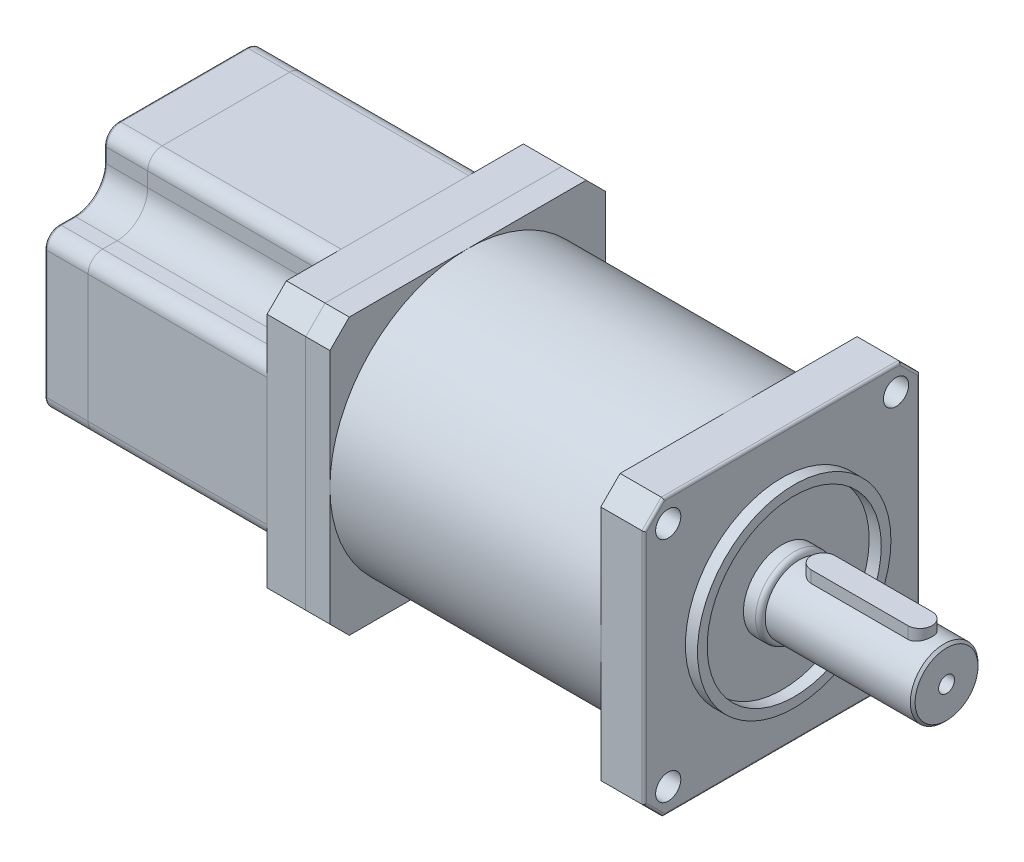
SolidWorks part; units mm, degrees
ref_plane "前视基准面" through (0, 0, 0) normal (0, 0, 1) x (1, 0, 0)
ref_plane "上视基准面" through (0, 0, 0) normal (0, 1, 0) x (1, 0, 0)
ref_plane "右视基准面" through (0, 0, 0) normal (1, 0, 0) x (0, 0, -1)
sketch "草图1" plane through (0, 0, 0) normal (1, 0, 0) x (0, 0, -1)
  line L0 (-28.5, 24.5) -> (-24.5, 28.5)
  line L1 (-24.5, -28.5) -> (24.5, -28.5)
  line L2 (-28.5, -24.5) -> (-28.5, 24.5)
  line L3 (-24.5, 28.5) -> (24.5, 28.5)
  line L4 (28.5, -24.5) -> (28.5, 24.5)
  line L5 (-28.5, -28.5) -> (28.5, 28.5) construction
  line L6 (-28.5, 28.5) -> (28.5, -28.5) construction
  line L7 (24.5, 28.5) -> (28.5, 24.5)
  line L8 (24.5, -28.5) -> (28.5, -24.5)
  line L9 (-28.5, -24.5) -> (-24.5, -28.5)
  point P0 (0, 0)
extrude "凸台-拉伸1" add sketch "草图1" against normal blind 9
sketch "草图2" plane through (-9, 0, 0) normal (-1, 0, 0) x (0, 0, 1)
  circle A0 centre (0, 0) radius 28.5
extrude "凸台-拉伸2" add sketch "草图2" along normal blind 56
sketch "草图3" plane through (-65, 0, 0) normal (-1, 0, 0) x (0, 0, 1)
  line L0 (0, 28.5) -> (24.5, 28.5) construction
  line L1 (-24.5, -28.5) -> (24.5, -28.5)
  line L2 (-28.5, -24.5) -> (-28.5, 24.5)
  line L3 (-24.5, 28.5) -> (24.5, 28.5)
  line L4 (28.5, -24.5) -> (28.5, 24.5)
  line L5 (-28.5, -28.5) -> (28.5, 28.5) construction
  line L6 (-28.5, 28.5) -> (28.5, -28.5) construction
  line L7 (-28.5, 24.5) -> (-24.5, 28.5)
  line L8 (24.5, 28.5) -> (28.5, 24.5)
  line L9 (24.5, -28.5) -> (28.5, -24.5)
  line L10 (-28.5, -24.5) -> (-24.5, -28.5)
  point P0 (0, 0)
extrude "凸台-拉伸3" add sketch "草图3" along normal blind 5
sketch "草图4" plane through (-70, 0, 0) normal (-1, 0, 0) x (0, 0, 1)
  line L0 (24.5, 28.5) -> (-24.5, 28.5) construction
  line L1 (-24.5, -28.5) -> (24.5, -28.5)
  line L2 (-28.5, -24.5) -> (-28.5, 24.5)
  line L3 (-24.5, 28.5) -> (24.5, 28.5)
  line L4 (28.5, -24.5) -> (28.5, 24.5)
  line L5 (-28.5, -28.5) -> (28.5, 28.5) construction
  line L6 (-28.5, 28.5) -> (28.5, -28.5) construction
  line L7 (-28.5, 24.5) -> (-24.5, 28.5)
  line L8 (24.5, 28.5) -> (28.5, 24.5)
  line L9 (24.5, -28.5) -> (28.5, -24.5)
  line L10 (-28.5, -24.5) -> (-24.5, -28.5)
  point P0 (0, 0)
extrude "凸台-拉伸4" add sketch "草图4" along normal blind 8 separate body
sketch "草图5" plane through (-78, 0, 0) normal (-1, 0, 0) x (0, 0, 1)
  line L0 (24.5, 28.5) -> (-24.5, 28.5) construction
  line L1 (-24.5, -28.5) -> (24.5, -28.5)
  line L2 (-28.5, -24.5) -> (-28.5, 24.5)
  line L3 (-24.5, 28.5) -> (24.5, 28.5)
  line L4 (28.5, -24.5) -> (28.5, 24.5)
  line L5 (-28.5, -28.5) -> (28.5, 28.5) construction
  line L6 (-28.5, 28.5) -> (28.5, -28.5) construction
  line L7 (-28.5, 24.5) -> (-24.5, 28.5)
  line L8 (-24.5, -28.5) -> (-28.5, -24.5)
  line L9 (24.5, -28.5) -> (28.5, -24.5)
  line L10 (28.5, 24.5) -> (24.5, 28.5)
  point P0 (0, 0)
extrude "凸台-拉伸5" add sketch "草图5" along normal blind 37 separate body
sketch "草图6" plane through (-115, 0, 0) normal (-1, 0, 0) x (0, 0, 1)
  line L0 (24.5, 28.5) -> (-24.5, 28.5) construction
  line L1 (-24.5, -28.5) -> (24.5, -28.5)
  line L2 (-28.5, -24.5) -> (-28.5, 24.5)
  line L3 (-24.5, 28.5) -> (24.5, 28.5)
  line L4 (28.5, -24.5) -> (28.5, 24.5)
  line L5 (-28.5, -28.5) -> (28.5, 28.5) construction
  line L6 (-28.5, 28.5) -> (28.5, -28.5) construction
  line L7 (-28.5, 24.5) -> (-24.5, 28.5)
  line L8 (-24.5, -28.5) -> (-28.5, -24.5)
  line L9 (24.5, -28.5) -> (28.5, -24.5)
  line L10 (28.5, 24.5) -> (24.5, 28.5)
  point P0 (0, 0)
extrude "凸台-拉伸6" add sketch "草图6" along normal blind 9 separate body
sketch "草图7" plane through (-124, 0, 0) normal (-1, 0, 0) x (0, 0, 1)
  line L0 (-22.5, 16.1754) -> (-25.5, 16.1754)
  line L1 (-28.5, 13.1754) -> (-28.5, 24.5)
  line L2 (-28.5, 24.5) -> (-24.5, 28.5)
  line L3 (-24.5, 28.5) -> (-13.1754, 28.5)
  line L4 (13.1754, 28.5) -> (24.5, 28.5)
  line L5 (24.5, 28.5) -> (28.5, 24.5)
  line L6 (28.5, 24.5) -> (28.5, 13.1754)
  line L7 (-28.5, 24.5) -> (-28.5, -24.5) construction
  line L9 (-25.5, -16.1754) -> (-22.5, -16.1754)
  line L10 (28.5, -13.1754) -> (28.5, -24.5)
  line L11 (-16.1754, -22.5) -> (-16.1754, -25.5)
  line L12 (-24.5, -28.5) -> (24.5, -28.5) construction
  line L14 (16.1754, -25.5) -> (16.1754, -22.5)
  line L15 (28.5, -24.5) -> (24.5, -28.5)
  line L16 (22.5, -16.1754) -> (25.5, -16.1754)
  line L17 (28.5, -24.5) -> (28.5, 24.5) construction
  line L19 (25.5, 16.1754) -> (22.5, 16.1754)
  line L20 (24.5, -28.5) -> (13.1754, -28.5)
  line L21 (16.1754, 22.5) -> (16.1754, 25.5)
  line L22 (24.5, 28.5) -> (-24.5, 28.5) construction
  line L24 (-16.1754, 25.5) -> (-16.1754, 22.5)
  line L25 (-13.1754, -28.5) -> (-24.5, -28.5)
  line L26 (-24.5, -28.5) -> (-28.5, -24.5)
  line L27 (-28.5, -24.5) -> (-28.5, -13.1754)
  arc A0 (-22.5, 16.1754) -> (-16.1754, 22.5) centre (-22.5, 22.5) ccw
  arc A1 (16.1754, 22.5) -> (22.5, 16.1754) centre (22.5, 22.5) ccw
  arc A2 (22.5, -16.1754) -> (16.1754, -22.5) centre (22.5, -22.5) ccw
  arc A3 (-16.1754, -22.5) -> (-22.5, -16.1754) centre (-22.5, -22.5) ccw
  arc A4 (-13.1754, 28.5) -> (-16.1754, 25.5) centre (-13.1754, 25.5) ccw
  arc A5 (16.1754, 25.5) -> (13.1754, 28.5) centre (13.1754, 25.5) ccw
  arc A6 (28.5, 13.1754) -> (25.5, 16.1754) centre (25.5, 13.1754) ccw
  arc A7 (25.5, -16.1754) -> (28.5, -13.1754) centre (25.5, -13.1754) ccw
  arc A8 (13.1754, -28.5) -> (16.1754, -25.5) centre (13.1754, -25.5) ccw
  arc A9 (-16.1754, -25.5) -> (-13.1754, -28.5) centre (-13.1754, -25.5) ccw
  arc A10 (-28.5, -13.1754) -> (-25.5, -16.1754) centre (-25.5, -13.1754) ccw
  arc A11 (-25.5, 16.1754) -> (-28.5, 13.1754) centre (-25.5, 13.1754) ccw
  point P0 (0, 0)
  point P10 (-16.1754, 28.5)
  point P39 (16.1754, 28.5)
  point P42 (28.5, 16.1754)
  point P45 (28.5, -16.1754)
  point P48 (16.1754, -28.5)
  point P51 (-16.1754, -28.5)
  point P54 (-28.5, -16.1754)
  point P57 (-28.5, 16.1754)
  dimension "D1" = 3
extrude "切除-拉伸1" cut sketch "草图7" against normal blind 46
fillet "圆角1" radius 0.5 24 edges at (-124, 28.5, 0) (-124, 27.6213, 15.2968) (-124, 24, 16.1754) (-124, 18.0279, 18.0279) (-124, 16.1754, 24) (-124, 15.2968, 27.6213) (-124, 0, 28.5) (-124, -15.2968, 27.6213) (-124, -16.1754, 24) (-124, -18.0279, 18.0279) (-124, -24, 16.1754) (-124, -27.6213, 15.2968) (-124, -28.5, 0) (-124, -27.6213, -15.2968) (-124, -24, -16.1754) (-124, -18.0279, -18.0279) (-124, -16.1754, -24) (-124, -15.2968, -27.6213) (-124, 0, -28.5) (-124, 15.2968, -27.6213) (-124, 16.1754, -24) (-124, 18.0279, -18.0279) (-124, 24, -16.1754) (-124, 27.6213, -15.2968)
fillet "圆角2" radius 0.5 8 edges at (0, 26.5, -26.5) (0, 0, -28.5) (0, -26.5, -26.5) (0, -28.5, 0) (0, -26.5, 26.5) (0, 0, 28.5) (0, 26.5, 26.5) (0, 28.5, 0)
sketch "草图8" plane through (0, 0, 0) normal (1, 0, 0) x (0, 0, -1)
  circle A0 centre (-23.55, 23.55) radius 2.6
  circle A1 centre (23.55, 23.55) radius 2.6
  circle A2 centre (23.55, -23.55) radius 2.6
  circle A3 centre (-23.55, -23.55) radius 2.6
  point P0 (0, 0)
extrude "切除-拉伸2" cut sketch "草图8" against normal blind 9
sketch "草图9" plane through (0, 0, 0) normal (1, 0, 0) x (0, 0, -1)
  circle A0 centre (0, 0) radius 20
  circle A1 centre (0, 0) radius 18
extrude "凸台-拉伸7" add sketch "草图9" along normal blind 2.5
sketch "草图10" plane through (0, 0, 0) normal (1, 0, 0) x (0, 0, -1)
  circle A0 centre (0, 0) radius 8
extrude "凸台-拉伸8" add sketch "草图10" along normal blind 3.5
fillet "圆角3" radius 1 1 edges at (3.5, 0, -8)
sketch "草图11" plane through (3.5, 0, 0) normal (1, 0, 0) x (0, 0, -1)
  circle A0 centre (0, 0) radius 7
extrude "凸台-拉伸9" add sketch "草图11" along normal blind 30.5 separate body
ref_plane "基准面1" through (0, 7, 0) normal (0, 1, 0) x (1, 0, 0)
sketch "草图12" plane through (0, 7, 0) normal (0, 1, 0) x (1, 0, 0)
  line L4 (8.5, 2.5) -> (28.5, 2.5)
  line L6 (28.5, -2.5) -> (8.5, -2.5)
  arc A0 (28.5, -2.5) -> (28.5, 2.5) centre (28.5, 0) ccw
  arc A1 (8.5, 2.5) -> (8.5, -2.5) centre (8.5, 0) ccw
extrude "切除-拉伸3" cut sketch "草图12" against normal blind 3
sketch "草图13" plane through (0, 4, 0) normal (0, 1, 0) x (1, 0, 0)
  line L0 (28.5, 2.5) -> (8.5, 2.5)
  line L2 (8.5, -2.5) -> (28.5, -2.5)
  arc A0 (8.5, 2.5) -> (8.5, -2.5) centre (8.5, 0) ccw
  arc A1 (28.5, -2.5) -> (28.5, 2.5) centre (28.5, 0) ccw
extrude "凸台-拉伸10" add sketch "草图13" along normal blind 5 separate body
chamfer "倒角1" distance 0.5 angle 45 1 edges at (34, 0, -7)
sketch "草图14" plane through (34, 0, 0) normal (1, 0, 0) x (0, 0, -1)
  point P0 (0, 0)
hole_wizard "M4 螺纹孔1" positions "3D草图3" profile "草图16" tap size "M4" standard "GB"
sketch3d "3D草图3"
  point P0 (34, 0, 0)
sketch "草图16" plane through (34, 0, 0) normal (0, 1, 0) x (0, 0, -1)
  line L0 (0, 0) -> (0, 10.4914)
  line L1 (0, 10.4914) -> (1.65, 9.5)
  line L2 (1.65, 9.5) -> (1.65, 0)
  line L5 (1.65, 0) -> (0, 0)
  line L10 (0, 10.4914) -> (-1.65, 9.5) construction
  line L11 (0, -6.35) -> (0, 107.95) construction
  dimension "螺纹孔钻头直径" = 3.3
  dimension "螺纹孔钻头深度" = 9.5
  dimension "导头角度" = 118
